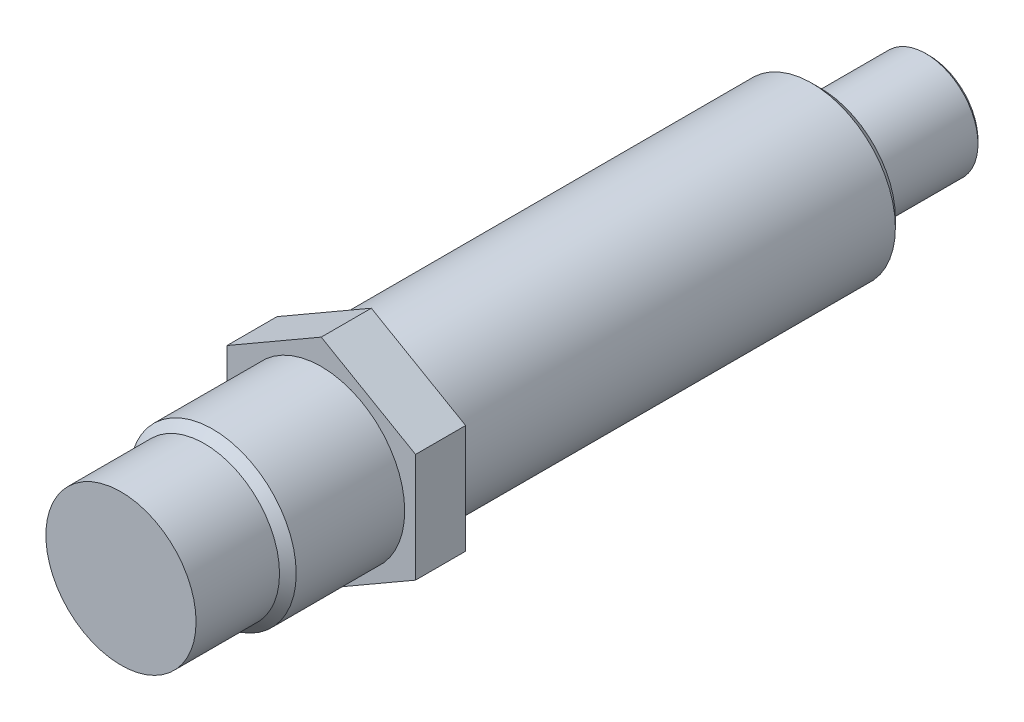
SolidWorks part; units mm, degrees
ref_plane "Front" through (0, 0, 0) normal (0, 0, 1) x (1, 0, 0)
ref_plane "Top" through (0, 0, 0) normal (0, 1, 0) x (1, 0, 0)
ref_plane "Right" through (0, 0, 0) normal (1, 0, 0) x (0, 0, -1)
sketch "Sketch1" plane through (0, 0, 0) normal (1, 0, 0) x (0, 0, -1)
  line L0 (0, 0) -> (122.9995, 0) construction
  line L1 (122.9995, 0) -> (122.9995, 7.4295)
  line L2 (122.4915, 7.9375) -> (108.712, 7.9375)
  line L3 (108.712, 7.9375) -> (108.712, 3.175)
  line L4 (108.712, 3.175) -> (106.426, 3.175)
  line L5 (106.426, 3.175) -> (106.426, 11.43)
  line L6 (105.156, 12.7) -> (13.97, 12.7)
  line L7 (13.97, 12.7) -> (12.7, 11.43)
  line L8 (12.7, 11.43) -> (0, 11.43)
  line L9 (0, 11.43) -> (0, 0)
  line L10 (122.9995, 7.4295) -> (122.4915, 7.9375)
  line L11 (0, 0) -> (122.9995, 0)
  line L12 (105.156, 12.7) -> (106.426, 11.43)
  point P3 (122.9995, 7.9375)
  dimension "D1" = 15.875
  dimension "D2" = 6.35
  dimension "D4" = 22.86
  dimension "D5" = 25.4
  dimension "D6" = 12.7
  dimension "D7" = 135
  dimension "D8" = 106.426
  dimension "D9" = 122.9995
  dimension "D10" = 45
  dimension "D11" = 14.2875
  dimension "D12" = 11.43
  dimension "D13" = 2.286
revolve "SHOCK" add sketch "Sketch1"
extrude "NUT" add sketch "Sketch4" along normal blind 7.62
sketch "Sketch4" plane through (0, 0, -38.1) normal (0, 0, 1) x (1, 0, 0)
  line L1 (14.351, -8.2856) -> (14.351, 8.2856)
  line L2 (14.351, 8.2856) -> (0, 16.5711)
  line L3 (0, 16.5711) -> (-14.351, 8.2856)
  line L4 (-14.351, 8.2856) -> (-14.351, -8.2856)
  line L5 (-14.351, -8.2856) -> (0, -16.5711)
  line L6 (0, -16.5711) -> (14.351, -8.2856)
  circle A0 centre (0, 0) radius 14.351 construction
  dimension "D1" = 28.702
ref_plane "Plane2" through (0, 0, -38.1) normal (0, 0, 1) x (1, 0, 0)
